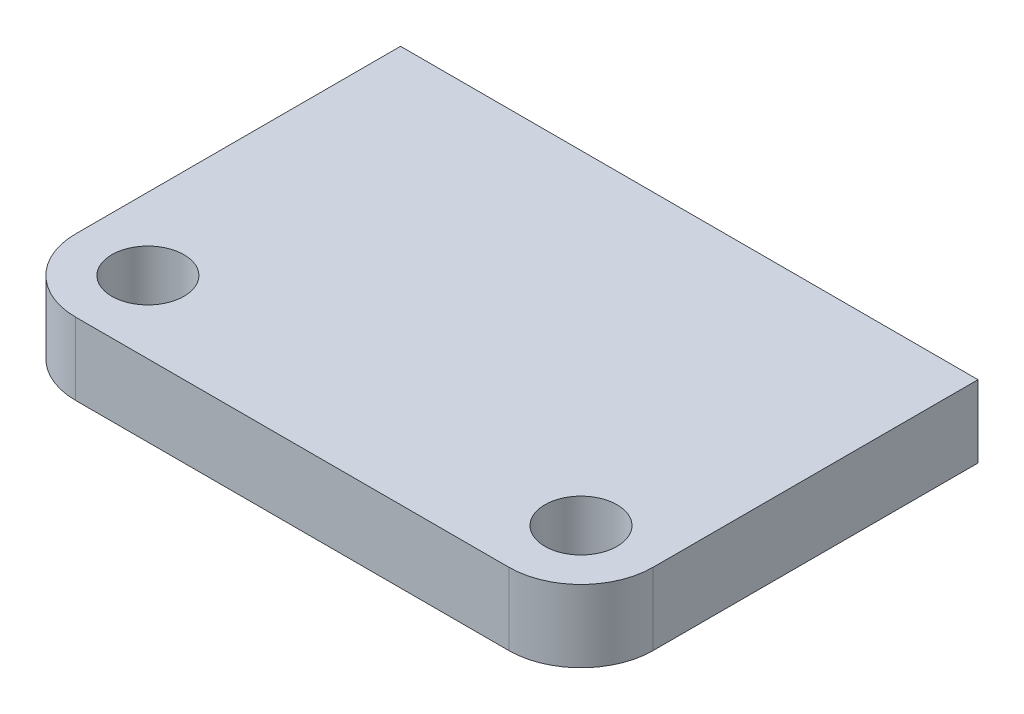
SolidWorks part; units mm, degrees
ref_plane "前视基准面" through (0, 0, 0) normal (0, 0, 1) x (1, 0, 0)
ref_plane "上视基准面" through (0, 0, 0) normal (0, 1, 0) x (1, 0, 0)
ref_plane "右视基准面" through (0, 0, 0) normal (1, 0, 0) x (0, 0, -1)
sketch "草图1" plane through (0, 0, 0) normal (0, 1, 0) x (1, 0, 0)
  line L0 (0, 0) -> (0, -69.2948) construction
  line L1 (40, 0) -> (-40, 0)
  line L2 (-40, 0) -> (-40, -45)
  line L3 (-30, -55) -> (30, -55)
  line L4 (40, 0) -> (40, -45)
  arc A0 (-30, -55) -> (-40, -45) centre (-30, -45) cw
  circle A1 centre (-30, -45) radius 5
  arc A2 (30, -55) -> (40, -45) centre (30, -45) ccw
  circle A3 centre (30, -45) radius 5
  point P9 (-40, -55)
  point P15 (0, -55)
  point P16 (0, 0)
  dimension "D3" = 10
  dimension "D4" = 10
  dimension "D1" = 40
  dimension "D2" = 55
extrude "凸台-拉伸1" add sketch "草图1" along normal blind 10
sketch "草图2" plane through (0, 0, 0) normal (0, 0, 1) x (1, 0, 0)
  line L0 (0, -5.3852) -> (0, 86.7374) construction
  line L1 (-43.2807, 50) -> (44.1855, 50) construction
  line L2 (-29.5476, 50) -> (-30, 10)
  line L3 (-30, 10) -> (30, 10)
  line L4 (30, 10) -> (30.4524, 50)
  arc A0 (-29.5476, 50) -> (30.4524, 50) centre (0.4524, 50) cw
  circle A1 centre (0, 50) radius 15
  dimension "D2" = 30
  dimension "D3" = 30
  dimension "D1" = 40
